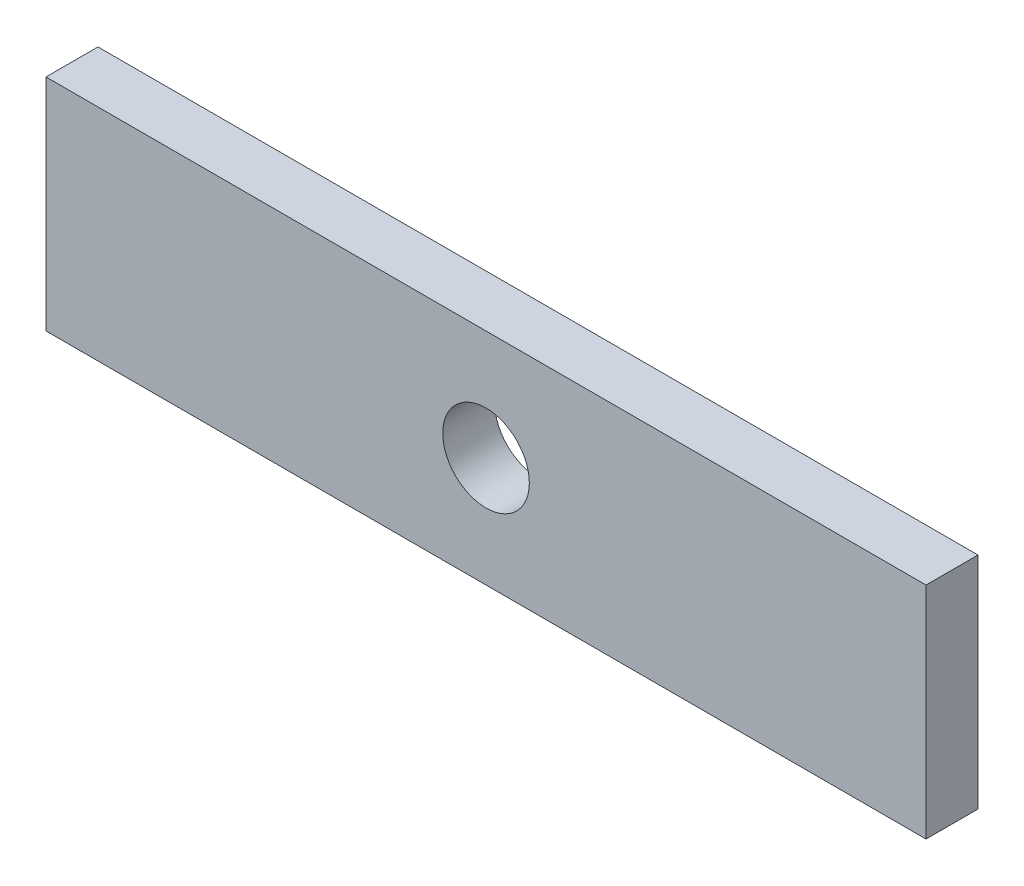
SolidWorks part; units mm, degrees
ref_plane "Front Plane" through (0, 0, 0) normal (0, 0, 1) x (1, 0, 0)
ref_plane "Top Plane" through (0, 0, 0) normal (0, 1, 0) x (1, 0, 0)
ref_plane "Right Plane" through (0, 0, 0) normal (1, 0, 0) x (0, 0, -1)
sketch "Sketch1" plane through (0, 0, 0) normal (0, 0, 1) x (1, 0, 0)
  line L1 (-25.4, 6.35) -> (25.4, 6.35)
  line L2 (-25.4, 6.35) -> (-25.4, -6.35)
  line L3 (-25.4, -6.35) -> (25.4, -6.35)
  line L4 (25.4, 6.35) -> (25.4, -6.35)
  line L5 (-25.4, 6.35) -> (25.4, -6.35) construction
  line L6 (-25.4, -6.35) -> (25.4, 6.35) construction
  circle A0 centre (0, 0) radius 2.5
  point P0 (0, 0)
  dimension "D3" = 5
  dimension "D1" = 50.8
  dimension "D2" = 12.7
  dimension "D4" = 6.35
  dimension "D5" = 25.4
extrude "Boss-Extrude1" add sketch "Sketch1" along normal blind 3
